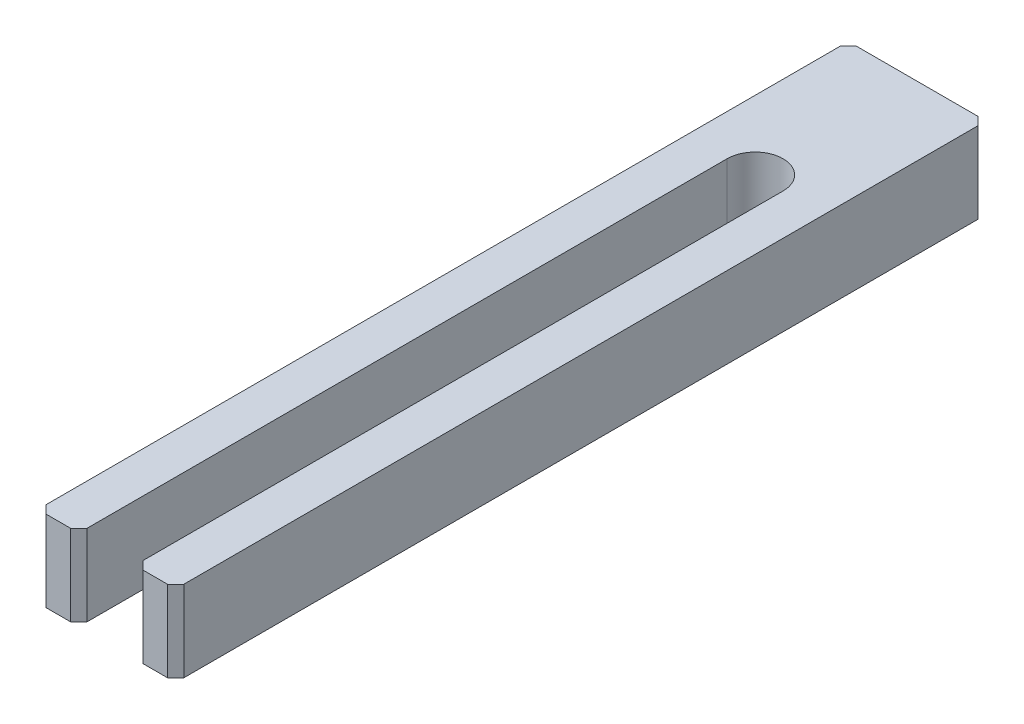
SolidWorks part; units mm, degrees
ref_plane "Face" through (0, 0, 0) normal (0, 0, 1) x (1, 0, 0)
ref_plane "Dessus" through (0, 0, 0) normal (0, 1, 0) x (1, 0, 0)
ref_plane "Droite" through (0, 0, 0) normal (1, 0, 0) x (0, 0, -1)
sketch "Esquisse1" plane through (0, 0, 0) normal (0, 1, 0) x (1, 0, 0)
  line L0 (0, 0) -> (0, 63.4587) construction
  line L1 (-17, 100) -> (17, 100)
  line L2 (-17, 100) -> (-17, -100)
  line L3 (-17, -100) -> (17, -100)
  line L4 (17, 100) -> (17, -100)
  line L5 (0, 0) -> (-70.559, 0) construction
  dimension "D1" = 34
  dimension "D2" = 200
extrude "Boss.-Extru.1" add sketch "Esquisse1" along normal blind 20
sketch "Esquisse2" plane through (0, 20, 0) normal (0, 1, 0) x (1, 0, 0)
  line L0 (0, 0) -> (0, 60) construction
  circle A0 centre (0, 60) radius 6.9
  dimension "D1" = 13.8
  dimension "D2" = 60
extrude "Enlèv. mat.-Extru.1" cut sketch "Esquisse2" against normal through all
sketch "Esquisse3" plane through (0, 20, 0) normal (0, 1, 0) x (1, 0, 0)
  line L0 (-17, -100) -> (17, -100) construction
  line L1 (-6.9, -100) -> (6.9, -100)
  line L2 (-6.9, -100) -> (-6.9, 60)
  line L3 (-6.9, 60) -> (6.9, 60)
  line L4 (6.9, -100) -> (6.9, 60)
  line L5 (0, 0) -> (0, -100) construction
  circle A0 centre (0, 60) radius 6.9 construction
  dimension "D1" = 13.8
extrude "Enlèv. mat.-Extru.2" cut sketch "Esquisse3" against normal through all
chamfer "Chanfrein1" distance 2 angle 45 6 edges at (17, 10, 100) (6.9, 10, 100) (-6.9, 10, 100) (-17, 10, 100) (17, 10, -100) (-17, 10, -100)
